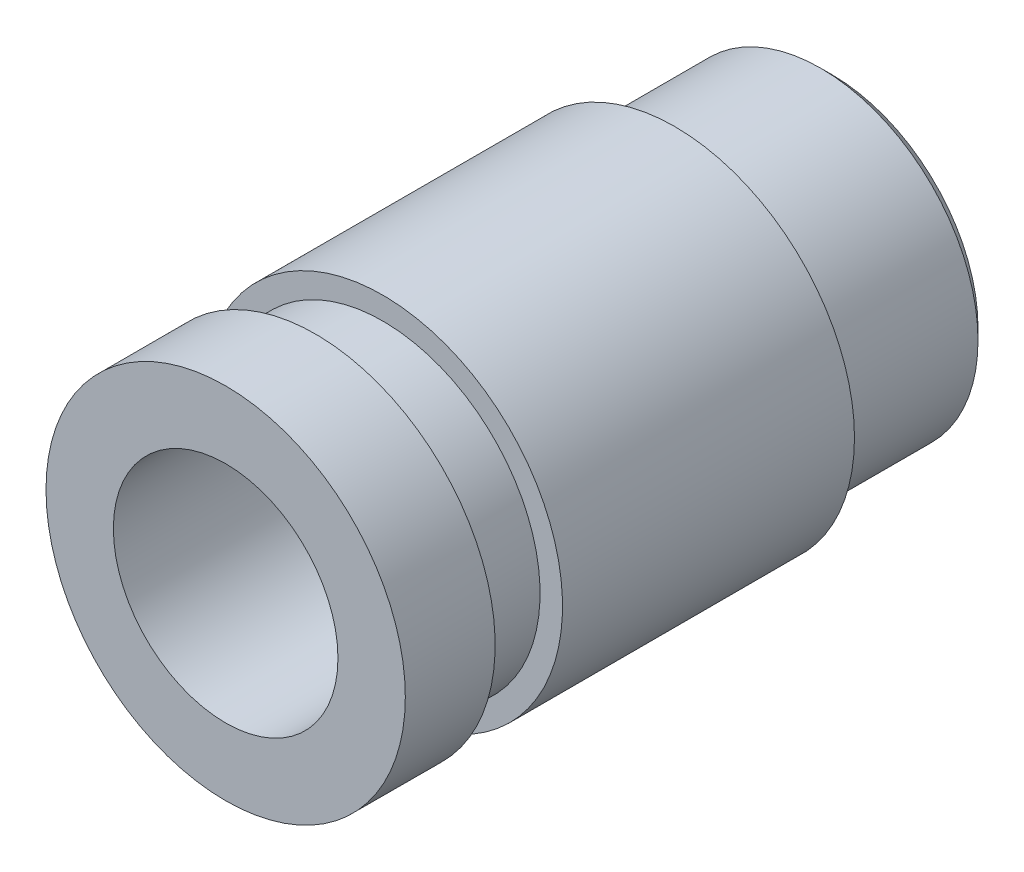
SolidWorks part; units mm, degrees
ref_plane "Front" through (0, 0, 0) normal (0, 0, 1) x (1, 0, 0)
ref_plane "Top" through (0, 0, 0) normal (0, 1, 0) x (1, 0, 0)
ref_plane "Right" through (0, 0, 0) normal (1, 0, 0) x (0, 0, -1)
sketch "Esquisse1" plane through (0, 0, 0) normal (0, 0, 1) x (1, 0, 0)
  circle A0 centre (0, 0) radius 4
  dimension "D1" = 8
extrude "Boss.-Extru.1" add sketch "Esquisse1" along normal blind 10
sketch "Esquisse2" plane through (0, 0, 0) normal (0, 0, -1) x (-1, 0, 0)
  circle A0 centre (0, 0) radius 3.5
  dimension "D1" = 7
extrude "Boss.-Extru.2" add sketch "Esquisse2" along normal blind 3.5
chamfer "Chanfrein1" distance 0.25 angle 45 1 edges at (-3.5, 0, -3.5)
sketch "Esquisse3" plane through (0, 0, -3.5) normal (0, 0, -1) x (-1, 0, 0)
  circle A0 centre (0, 0) radius 2.5
  dimension "D1" = 5
extrude "Enlèv. mat.-Extru.1" cut sketch "Esquisse3" against normal up to next
sketch "Esquisse5" plane through (0, 0, 0) normal (1, 0, 0) x (0, 0, -1)
  line L0 (0, 0) -> (-10, 0) construction
  line L1 (-10, 4) -> (-10, -4) construction
  line L2 (0, 4) -> (-10, 4) construction
  line L3 (-8, 4) -> (-6.5, 4)
  line L4 (-8, 4) -> (-8, 3.5)
  line L5 (-8, 3.5) -> (-6.5, 3.5)
  line L6 (-6.5, 4) -> (-6.5, 3.5)
  dimension "D1" = 2
  dimension "D2" = 1.5
  dimension "D3" = 3.5
revolve "Enlèvement de matière-Révolution1" cut sketch "Esquisse5" angle 360 about L0
